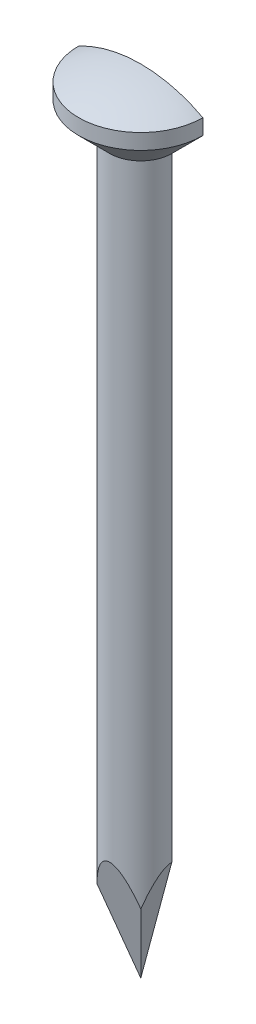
SolidWorks part; units mm, degrees
ref_plane "face" through (0, 0, 0) normal (0, 0, 1) x (1, 0, 0)
ref_plane "dessus" through (0, 0, 0) normal (0, 1, 0) x (1, 0, 0)
ref_plane "profil" through (0, 0, 0) normal (1, 0, 0) x (0, 0, -1)
sketch "Esquisse1" plane through (0, 0, 0) normal (0, 0, 1) x (1, 0, 0)
  line L0 (0, 0) -> (0, 25)
  line L1 (0, 0) -> (1, 0)
  line L2 (1, 0) -> (1, 23.5)
  line L3 (1, 23.5) -> (2, 24.5)
  line L4 (0, 31.5099) -> (0, -2.2698) construction
  line L5 (2, 24.5) -> (2, 25)
  line L7 (2, 25) -> (0, 25)
  dimension "D1" = 1
  dimension "D2" = 1
  dimension "D3" = 2
  dimension "D4" = 0.5
  dimension "D5" = 25
revolve "Base-Révolution" add sketch "Esquisse1" angle 360 about L4
dome "Dôme2" faces to dome 1 distance 0.5 parameters "D1"=0.5
sketch "Esquisse2" plane through (0, 0, 0) normal (0, 0, 1) x (1, 0, 0)
  line L0 (1, 0) -> (1, 3.7283)
  line L4 (-1, 0) -> (1, 0) construction
  line L6 (1, 0) -> (1, 23.5) construction
  line L7 (1, 3.7283) -> (0.001, 0)
  line L8 (0.001, 0) -> (1, 0)
  dimension "D1" = 0.999
  dimension "D2" = 75
extrude "Enlèv. mat.-Extru.1" cut sketch "Esquisse2" against normal mid plane 5
pattern_circular "Répétition circulaire2" count 4 over 360 about axis through (0, 31.5099, 0) along (0, -1, 0)
sketch "Esquisse4" plane through (0, 0, 0) normal (0, 0, 1) x (1, 0, 0)
  line L1 (-2.6329, 26.1316) -> (2.4396, 26.1316)
  line L2 (-2.6329, 26.1316) -> (-2.6329, -0.3901)
  line L3 (-2.6329, -0.3901) -> (2.4396, -0.3901)
  line L4 (2.4396, 26.1316) -> (2.4396, -0.3901)
extrude "Enlèv. mat.-Extru.3" cut sketch "Esquisse4" against normal up to next
